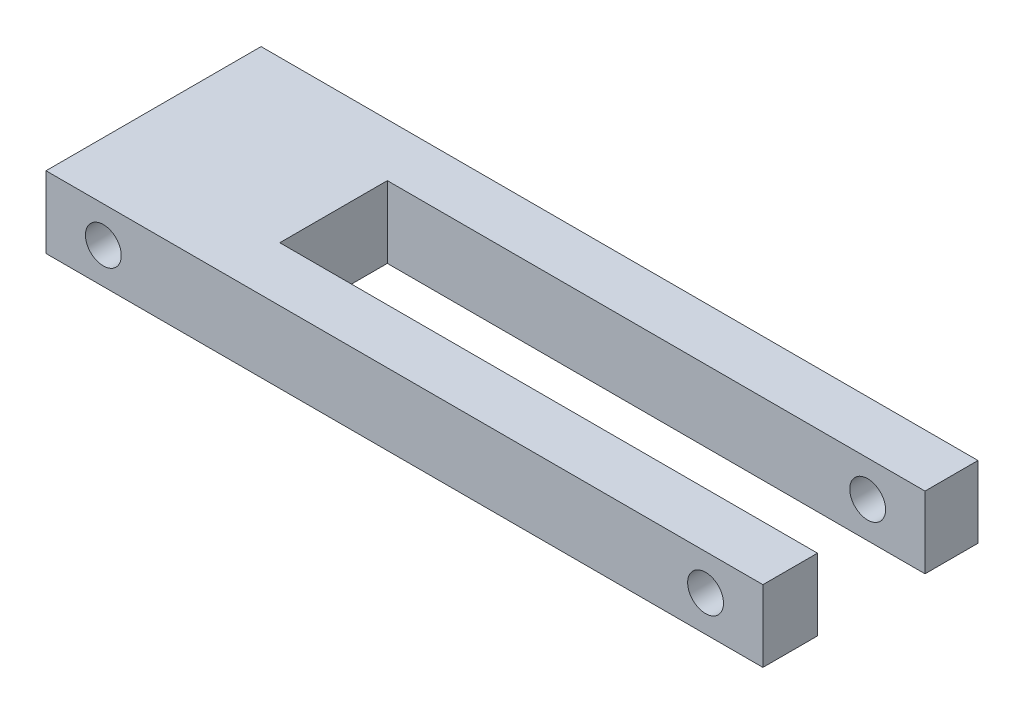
SolidWorks part; units mm, degrees
ref_plane "Front Plane" through (0, 0, 0) normal (0, 0, 1) x (1, 0, 0)
ref_plane "Top Plane" through (0, 0, 0) normal (0, 1, 0) x (1, 0, 0)
ref_plane "Right Plane" through (0, 0, 0) normal (1, 0, 0) x (0, 0, -1)
ref_plane "Plane1" through (0, 0, 0) normal (0, -1, 0) x (-1, 0, 0)
sketch "Base Boundaries" plane through (0, 0, 0) normal (0, -1, 0) x (-1, 0, 0)
  line L0 (0, 0) -> (0, 247.7925) construction
  line L1 (0, 0) -> (0, -252.2075) construction
  line L2 (0, 0) -> (-500, 0) construction
  line L3 (0, 0) -> (500, 0) construction
  line L4 (-500, 0) -> (-500, 247.7925) construction
  line L5 (-500, 247.7925) -> (0, 247.7925) construction
  line L6 (0, 247.7925) -> (500, 247.7925) construction
  line L7 (500, 247.7925) -> (500, 0) construction
  line L8 (500, 0) -> (500, -252.2075) construction
  line L9 (500, -252.2075) -> (0, -252.2075) construction
  line L10 (0, -252.2075) -> (-500, -252.2075) construction
  line L11 (-500, -252.2075) -> (-500, 0) construction
  line L12 (-500, 247.7925) -> (-500, 197.7925) construction
  line L13 (-500, 197.7925) -> (500, 197.7925) construction
  line L14 (500, 197.7925) -> (500, 247.7925) construction
  line L15 (-500, -252.2075) -> (-500, -202.2075) construction
  line L16 (-500, -202.2075) -> (0, -202.2075) construction
  line L17 (0, -202.2075) -> (500, -202.2075) construction
  line L18 (500, -202.2075) -> (500, -252.2075) construction
  line L19 (-500, 247.7925) -> (0, 197.7925) construction
  line L20 (0, 197.7925) -> (500, 247.7925) construction
  line L21 (0, 247.7925) -> (500, 197.7925) construction
  line L22 (0, 247.7925) -> (-500, 197.7925) construction
  line L23 (-500, -252.2075) -> (0, -202.2075) construction
  line L24 (0, -202.2075) -> (500, -252.2075) construction
  line L25 (500, -202.2075) -> (0, -252.2075) construction
  line L26 (0, -252.2075) -> (-500, -202.2075) construction
  line L27 (-500, 197.7925) -> (-500, 147.7925) construction
  line L28 (-500, 147.7925) -> (500, 147.7925) construction
  line L29 (-500, -202.2075) -> (-500, -152.2075) construction
  line L30 (-500, -152.2075) -> (500, -152.2075) construction
  line L31 (500, -152.2075) -> (500, -202.2075) construction
  line L32 (-500, 147.7925) -> (500, 197.7925) construction
  line L33 (500, 147.7925) -> (-500, 197.7925) construction
  line L34 (-500, -202.2075) -> (500, -152.2075) construction
  line L35 (500, -202.2075) -> (-500, -152.2075) construction
  dimension "D1" = 500
  dimension "D2" = 1000
  dimension "D3" = 50
  dimension "D4" = 50
  dimension "D5" = 50
  dimension "D6" = 50
sketch "Wheel Lines" plane through (0, 0, 0) normal (0, -1, 0) x (-1, 0, 0)
  line L0 (-500, 247.7925) -> (-500, 197.7925) construction
  line L1 (-500, 197.7925) -> (-340, 197.7925) construction
  line L2 (-500, 197.7925) -> (500, 197.7925) construction
  line L3 (-340, 197.7925) -> (-340, 247.7925) construction
  line L4 (-500, 247.7925) -> (0, 247.7925) construction
  line L5 (-340, 247.7925) -> (-500, 247.7925) construction
  line L6 (-500, -202.2075) -> (-500, -252.2075) construction
  line L7 (-500, -252.2075) -> (-340, -202.2075) construction
  line L8 (-500, -202.2075) -> (0, -202.2075) construction
  line L9 (-340, -202.2075) -> (-340, -252.2075) construction
  line L10 (0, -252.2075) -> (-500, -252.2075) construction
  line L11 (-340, -252.2075) -> (-500, -202.2075) construction
  line L12 (500, 247.7925) -> (340, 247.7925) construction
  line L13 (0, 247.7925) -> (500, 247.7925) construction
  line L14 (340, 247.7925) -> (500, 197.7925) construction
  line L15 (500, 197.7925) -> (340, 197.7925) construction
  line L16 (340, 197.7925) -> (340, 247.7925) construction
  line L17 (500, -202.2075) -> (340, -202.2075) construction
  line L18 (0, -202.2075) -> (500, -202.2075) construction
  line L19 (340, -202.2075) -> (340, -252.2075) construction
  line L20 (500, -252.2075) -> (0, -252.2075) construction
  line L21 (340, -252.2075) -> (500, -202.2075) construction
  line L22 (500, -202.2075) -> (500, -252.2075) construction
  line L23 (500, -252.2075) -> (340, -202.2075) construction
  line L24 (-340, 247.7925) -> (-500, 197.7925) construction
  line L25 (-500, 247.7925) -> (-340, 197.7925) construction
  line L26 (340, 197.7925) -> (500, 247.7925) construction
  line L27 (420, 222.7925) -> (420, -227.2075) construction
  line L28 (-420, 222.7925) -> (-420, -227.2075) construction
  dimension "D1" = 160
  dimension "D2" = 160
  dimension "D3" = 160
  dimension "D4" = 160
ref_plane "Plane2" through (0, 0, 0) normal (0, -1, 0) x (-1, 0, 0)
sketch "Sketch5" plane through (0, 0, 0) normal (0, -1, 0) x (-1, 0, 0)
  line L0 (-500, 147.7925) -> (500, 147.7925)
  line L1 (500, 147.7925) -> (500, -152.2075)
  line L2 (500, -152.2075) -> (-500, -152.2075)
  line L3 (-500, 0) -> (0, -152.2075) construction
  line L4 (0, 0) -> (-500, -152.2075) construction
  line L5 (-250, -76.1038) -> (-500, -76.1038) construction
  line L6 (-500, -252.2075) -> (-500, 0) construction
  line L7 (-500, -76.1038) -> (500, -76.1038) construction
  line L8 (-500, 147.7925) -> (0, 0) construction
  line L9 (0, 147.7925) -> (-500, 0) construction
  line L10 (-250, 73.8962) -> (-500, 73.8962) construction
  line L11 (-500, 0) -> (-500, 247.7925) construction
  line L12 (-250, 73.8962) -> (500, 73.8962) construction
  line L13 (-500, 147.7925) -> (-500, 73.8962)
  line L14 (0, 147.7925) -> (500, 73.8962) construction
  line L15 (500, 147.7925) -> (0, 73.8962) construction
  line L16 (0, 0) -> (0, 247.7925) construction
  line L17 (250, 110.8444) -> (250, -76.1038) construction
  line L18 (-500, 73.8962) -> (250, 73.8962) construction
  line L19 (250, 73.8962) -> (250, -76.1038) construction
  line L20 (-500, 73.8962) -> (250, 73.8962)
  line L21 (250, 73.8962) -> (250, -76.1038)
  line L22 (250, -76.1038) -> (-500, -76.1038)
  line L23 (-500, -76.1038) -> (-500, -152.2075)
extrude "Boss-Extrude1" add sketch "Sketch5" along normal blind 100
sketch "Sketch6" plane through (0, -100, 0) normal (0, -1, 0) x (-1, 0, 0)
  line L0 (-420, 147.7925) -> (-420, 73.8962) construction
  line L1 (-500, 147.7925) -> (500, 147.7925) construction
  line L2 (-420, 222.7925) -> (-420, -227.2075) construction
  line L3 (-500, 73.8962) -> (250, 73.8962) construction
ref_plane "Plane3" through (0, 0, -147.7925) normal (0, 0, -1) x (-1, 0, 0)
sketch "Sketch8" plane through (0, 0, -147.7925) normal (0, 0, -1) x (-1, 0, 0)
  line L0 (-420, -100) -> (-420, 0) construction
  line L1 (-500, -50) -> (500, -50) construction
  line L3 (-500, -100) -> (-500, 0) construction
  line L4 (500, -100) -> (500, 0) construction
  line L5 (0, -50) -> (0, 0) construction
  line L6 (0, -50) -> (0, -100) construction
  line L7 (500, -100) -> (-500, -100) construction
  circle A0 centre (-420, -50) radius 25
  circle A1 centre (420, -50) radius 25
  dimension "D1" = 50
extrude "Cut-Extrude1" cut sketch "Sketch8" against normal up to surface (300 mm away) contours A0 | A1
